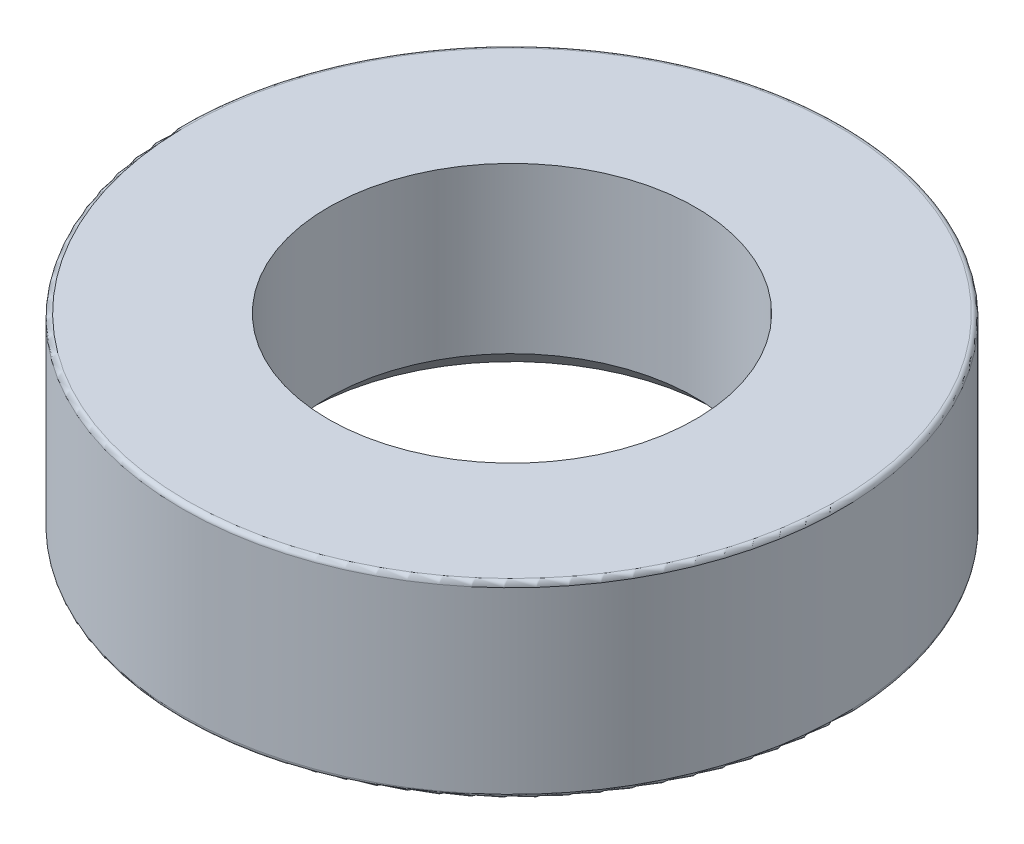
SolidWorks part; units mm, degrees
ref_plane "Front Plane" through (0, 0, 0) normal (0, 0, 1) x (1, 0, 0)
ref_plane "Top Plane" through (0, 0, 0) normal (0, 1, 0) x (1, 0, 0)
ref_plane "Right Plane" through (0, 0, 0) normal (1, 0, 0) x (0, 0, -1)
sketch "Sketch1" plane through (0, 0, 0) normal (0, 1, 0) x (1, 0, 0)
  circle A0 centre (0, 0) radius 7
  dimension "D1" = 14
extrude "Boss-Extrude1" add sketch "Sketch1" along normal mid plane 4
sketch "Sketch2" plane through (0, 2, 0) normal (0, 1, 0) x (1, 0, 0)
  circle A0 centre (0, 0) radius 3.9
  dimension "D1" = 7.8
extrude "Cut-Extrude1" cut sketch "Sketch2" against normal up to next
chamfer "Chamfer1" distance 0.5 angle 45 1 edges at (0, -2, 3.9)
fillet "Fillet1" radius 0.1 2 edges at (0, -2, 7) (0, 2, 7)
